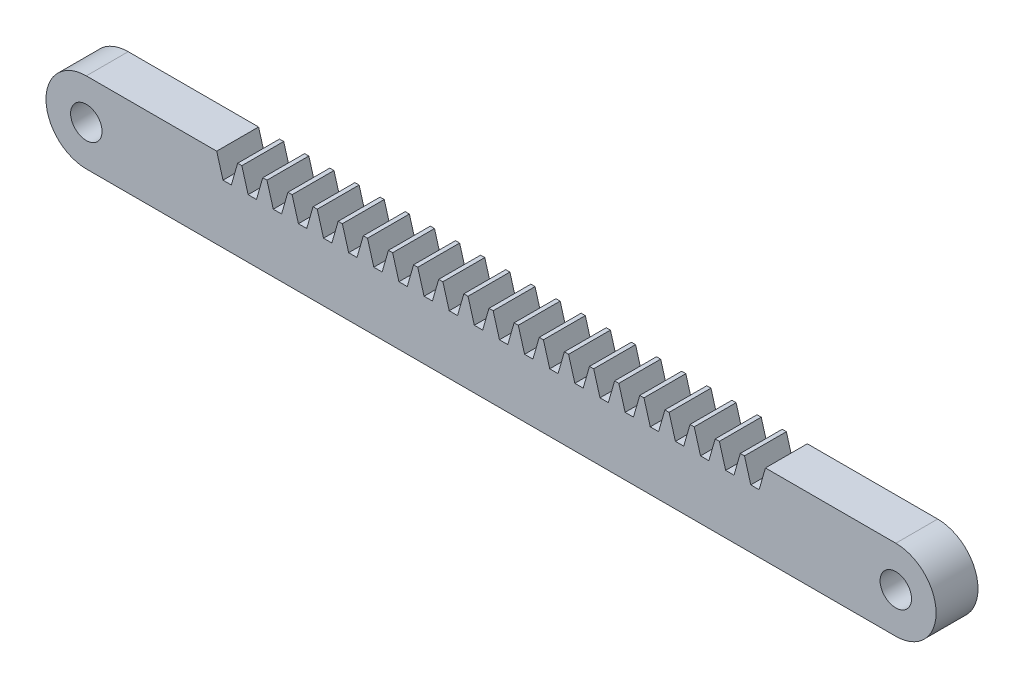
SolidWorks part; units mm, degrees
ref_plane "Спереди" through (0, 0, 0) normal (0, 0, 1) x (1, 0, 0)
ref_plane "Сверху" through (0, 0, 0) normal (0, 1, 0) x (1, 0, 0)
ref_plane "Справа" through (0, 0, 0) normal (1, 0, 0) x (0, 0, -1)
other "Configuration Table"
sketch "Эскиз1" plane through (0, 0, 0) normal (0, 1, 0) x (1, 0, 0)
  line L0 (0.382, -0.764) -> (0.382, 4.4532) construction
  line L1 (-42.118, 3.236) -> (42.882, 3.236)
  line L2 (-42.118, 3.236) -> (-42.118, -0.764)
  line L3 (-42.118, -0.764) -> (42.882, -0.764)
  line L4 (42.882, 3.236) -> (42.882, -0.764)
  dimension "D1" = 4
  dimension "D2" = 85
  dimension "D3" = 42.5
extrude "Бобышка-Вытянуть1" add sketch "Эскиз1" along normal blind 4.9
sketch "Эскиз2" plane through (0, 0, 0.764) normal (0, 0, 1) x (1, 0, 0)
  line L0 (0.382, 0) -> (0.382, 9.7604) construction
  line L1 (0.182, 7) -> (0.582, 7)
  line L2 (0.182, 7) -> (-0.4201, 4.9)
  line L3 (0.582, 7) -> (1.1842, 4.9)
  line L4 (-42.118, 0) -> (42.882, 0)
  line L5 (42.882, 0) -> (42.882, 4.9)
  line L6 (42.882, 4.9) -> (-42.118, 4.9)
  line L7 (-42.118, 4.9) -> (-42.118, 0)
  line L8 (-42.118, 0) -> (42.882, 0)
  line L9 (42.882, 0) -> (42.882, 4.9)
  line L10 (42.882, 4.9) -> (-42.118, 4.9)
  line L11 (-42.118, 4.9) -> (-42.118, 0)
  line L12 (-42.118, 4.9) -> (42.882, 4.9) construction
  dimension "D2" = 0.2
  dimension "D3" = 0.2
  dimension "D4" = 16
  dimension "D5" = 16
  dimension "D6" = 2.1
  dimension "D7" = 42.5
  dimension "D1" = 0
extrude "Бобышка-Вытянуть2" add sketch "Эскиз2" against normal up to surface (4 mm away) contours L10 L0 L1 L2 | L0 L3 L1 M11
pattern_linear "Линейный массив1" count 12 spacing 2.4 along (-1, 0, 0) of "Бобышка-Вытянуть2"
pattern_linear "Линейный массив2" count 12 spacing 2.4 along (1, 0, 0) of "Бобышка-Вытянуть2"
sketch "Эскиз3" plane through (0, 0, 0.764) normal (0, 0, 1) x (1, 0, 0)
  line L4 (-26.218, 7) -> (-42.118, 7)
  line L13 (-42.118, 0) -> (42.882, 0)
  line L14 (-42.118, 0) -> (-42.118, -0.7)
  line L15 (-42.118, -0.7) -> (42.882, -0.7)
  line L16 (42.882, 0) -> (42.882, -0.7)
  line L17 (-26.218, 7) -> (-26.218, 4.9)
  line L18 (-26.218, 4.9) -> (-42.118, 4.9)
  line L19 (-42.118, 7) -> (-42.118, 4.9)
  line L20 (26.982, 7) -> (42.882, 7)
  line L21 (26.982, 7) -> (26.982, 4.9)
  line L22 (26.982, 4.9) -> (42.882, 4.9)
  line L23 (42.882, 7) -> (42.882, 4.9)
  dimension "D1" = 0.7
extrude "Бобышка-Вытянуть3" add sketch "Эскиз3" against normal up to surface (4 mm away)
sketch "Эскиз4" plane through (0, 0, -3.236) normal (0, 0, -1) x (-1, 0, 0)
  line L1 (42.118, 7) -> (42.118, -0.7) construction
  line L2 (-42.882, -0.7) -> (-42.882, 7)
  line L3 (-42.882, 7) -> (-26.582, 7) construction
  line L5 (21.818, 7) -> (42.118, 7)
  line L6 (42.118, 7) -> (42.118, -0.7)
  line L7 (-42.882, -0.7) -> (42.118, -0.7)
  line L8 (-42.882, 7) -> (-26.582, 7)
  line L10 (-39.032, 7.4295) -> (-39.032, -0.4611) construction
  line L11 (-42.882, 3.15) -> (-34.6429, 3.15) construction
  line L12 (-0.382, -0.7) -> (-0.382, 9.4095) construction
  line L13 (42.118, 3.15) -> (33.8788, 3.15) construction
  line L14 (38.268, 7.4295) -> (38.268, -0.4611) construction
  line L15 (42.118, 7) -> (42.118, -0.7)
  circle A0 centre (-39.032, 3.15) radius 3.85
  circle A1 centre (-39.032, 3.15) radius 1.5
  circle A2 centre (38.268, 3.15) radius 1.5
  circle A3 centre (38.268, 3.15) radius 3.85
  dimension "D2" = 7.7
  dimension "D3" = 3
extrude "Вырез-Вытянуть1" cut sketch "Эскиз4" against normal up to surface (4 mm away)
